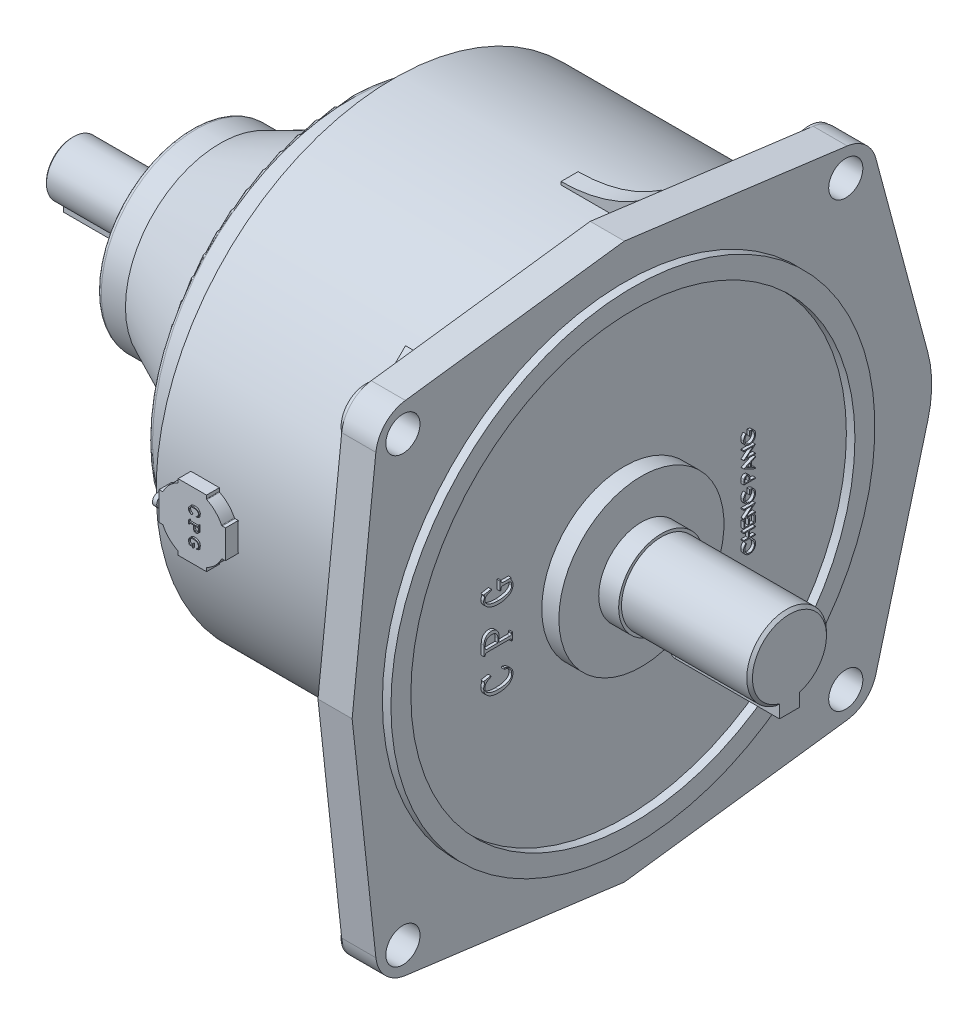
SolidWorks part; units mm, degrees
ref_plane "前视基准面" through (0, 0, 0) normal (0, 0, 1) x (1, 0, 0)
ref_plane "上视基准面" through (0, 0, 0) normal (0, 1, 0) x (1, 0, 0)
ref_plane "右视基准面" through (0, 0, 0) normal (1, 0, 0) x (0, 0, -1)
sketch "草图1" plane through (0, 0, 0) normal (0, 1, 0) x (1, 0, 0)
  line L0 (0, 0) -> (15.7361, 0) construction
  line L1 (0, 0) -> (0, -14)
  line L2 (0, -14) -> (-45, -14)
  line L3 (-45, -14) -> (-45, -15)
  line L4 (-45, -15) -> (-52, -15)
  line L5 (-55, -29) -> (-55, -85)
  line L6 (-55, -85) -> (-58, -85)
  line L7 (-58, -85) -> (-58, 0)
  line L8 (-58, 0) -> (0, 0)
  line L9 (-55, -29) -> (-52, -29)
  line L10 (-52, -29) -> (-52, -15)
  dimension "D1" = 45
  dimension "D2" = 28
  dimension "D3" = 30
  dimension "D4" = 3
  dimension "D5" = 170
  dimension "D6" = 58
  dimension "D7" = 3
  dimension "D8" = 58
revolve "旋转1" add sketch "草图1" angle 360 about L0
sketch "草图2" plane through (0, 0, 0) normal (0, 1, 0) x (1, 0, 0)
  line L0 (8.0167, 23) -> (-70, 23) construction
  line L4 (-70, 23) -> (-70, -60.5)
  line L5 (-70, -60.5) -> (-162, -60.5)
  line L6 (-162, -60.5) -> (-162, 23)
  line L11 (-70, 23) -> (-162, 23)
  dimension "D1" = 23
  dimension "D3" = 167
  dimension "D5" = 92
revolve "旋转2" add sketch "草图2" angle 360 about L0
sketch "草图12" plane through (-70, 0, 0) normal (1, 0, 0) x (0, 0, -1)
  line L0 (0, -97.5) -> (86.267, -86.267)
  line L1 (-86.267, -86.267) -> (0, -97.5)
  line L2 (-86.267, -86.267) -> (-95.6178, 0)
  line L3 (-86.267, 86.267) -> (0, 97.5)
  line L4 (86.267, -86.267) -> (109.3822, 0)
  line L5 (-95.6178, 0) -> (-86.267, 86.267)
  line L6 (0, 97.5) -> (86.267, 86.267)
  line L7 (109.3822, 0) -> (86.267, 86.267)
  line L8 (167.8979, 0) -> (-107.2143, 0) construction
  line L9 (0, 107.5085) -> (0, -103.3164) construction
  line L10 (0, 0) -> (-77.7817, 77.7817) construction
  line L11 (0, 0) -> (77.7817, 77.7817) construction
  circle A0 centre (0, 0) radius 110 construction
  circle A1 centre (-77.7817, 77.7817) radius 6
  circle A2 centre (77.7817, 77.7817) radius 6
  circle A3 centre (77.7817, -77.7817) radius 6
  circle A4 centre (-77.7817, -77.7817) radius 6
  dimension "D3" = 220
  dimension "D4" = 12
  dimension "D5" = 15
  dimension "D1" = 195
  dimension "D2" = 205
  dimension "D6" = 12
extrude "拉伸8" add sketch "草图12" along normal up to surface (12 mm away)
sketch "草图5" plane through (0, 0, 0) normal (0, 1, 0) x (1, 0, 0)
  line L0 (0, -3.5) -> (-36.5, -3.5)
  line L1 (0, -14) -> (0, 14) construction
  line L2 (-36.5, 3.5) -> (0, 3.5)
  line L3 (0, 3.5) -> (0, -3.5)
  line L4 (31.1, -13.7955) -> (31.1, 19.6443) construction
  arc A0 (-36.5, -3.5) -> (-36.5, 3.5) centre (-36.5, 0) cw
  dimension "D2" = 40
  dimension "D1" = 7
  dimension "D3" = 31.1
extrude "拉伸4" add sketch "草图5" against normal blind 17.1
fillet "圆角4" radius 12 4 edges at (-64, 86.267, 86.267) (-64, 86.267, -86.267) (-64, -86.267, -86.267) (-64, -86.267, 86.267)
fillet "圆角5" radius 40 1 edges at (-64, 0, -109.3822)
chamfer "倒角1" distance 1 angle 45 1 edges at (0, 14, 0)
sketch "草图18" plane through (-70, 0, 0) normal (-1, 0, 0) x (0, 0, 1)
  line L0 (-23, 0) -> (65.9169, -88.9169) construction
  line L1 (0, -89.1) -> (0, 89.1) construction
  line L2 (76.9039, -87.4862) -> (0, -97.5) construction
  line L3 (36.0434, -59.0434) -> (65.9169, -88.9169)
  line L4 (-23, 0) -> (-77.7817, -77.7817) construction
  line L5 (-76.7543, -75.4044) -> (-71.081, -68.2676)
  line L7 (-23, 0) -> (-23, -94.5051) construction
  line L8 (0, -97.5) -> (-78.3038, -87.3039) construction
  line L9 (-23, -83.5) -> (-23, -94.5051)
  circle A0 centre (-23, 0) radius 83.5 construction
  arc A1 (-88.3455, -78.5102) -> (-78.3038, -87.3039) centre (-76.7543, -75.4044) ccw construction
  circle A3 centre (-23, 0) radius 83.5 construction
  dimension "D1" = 45
  dimension "D2" = 9.117
  dimension "D4" = 42.2474
  dimension "D5" = 11.0051
ref_plane "基准面7" through (-71, 0, 0) normal (1, 0, 0) x (0, 0, -1)
sketch "草图13" plane through (-70, 0, 0) normal (1, 0, 0) x (0, 0, -1)
  line L5 (0, 0) -> (107.7406, 0) construction
  circle A1 centre (77.7817, 77.7817) radius 9.4101
  circle A3 centre (77.7817, 77.7817) radius 6
  circle A4 centre (77.7817, -77.7817) radius 6 construction
  circle A5 centre (77.7817, -77.7817) radius 6
  circle A7 centre (-77.7817, -77.7817) radius 6
  arc A10 (78.3038, -87.3039) -> (88.3455, -78.5102) centre (76.7543, -75.4044) ccw construction
  circle A11 centre (-77.7817, -77.7817) radius 6 construction
  arc A12 (-87.2845, -76.8798) -> (-76.9039, -87.4862) centre (-75.3544, -75.5867) ccw construction
  circle A14 centre (-77.7817, 77.7817) radius 6
  circle A15 centre (-77.7817, 77.7817) radius 8.7273
  circle A20 centre (-77.7817, -77.7817) radius 8.7273
  circle A21 centre (77.7817, -77.7817) radius 9.4101
  point P8 (23, 0)
extrude "拉伸9" add sketch "草图13" against normal up to surface (1 mm away)
sketch "草图14" plane through (0, 0, 0) normal (0, 1, 0) x (1, 0, 0)
  line L0 (-70, 23) -> (-162, 23) construction
  line L5 (-70, -76.9039) -> (-70, 0) construction
  line L6 (-100.2474, -60.5) -> (-100.2474, -61.5)
  line L7 (-70, -90.7474) -> (-71, -90.7474)
  line L9 (-70, -60.5) -> (-162, -60.5) construction
  arc A0 (-71, -90.7474) -> (-100.2474, -61.5) centre (-100.2474, -90.7474) ccw
  dimension "D1" = 113.7474
  dimension "D2" = 1
  dimension "D3" = 1
rib "筋17" sketch "草图14" sketch "草图14" thickness 6 extrusion direction parallel to sketch draft on no parameters "D1"=6
pattern_circular "阵列(圆周)16" count 8 over 360 about axis through (0, 0, -23) along (1, 0, 0) of "筋17"
ref_plane "基准面8" through (0, 0, -23) normal (0, 0, 1) x (1, 0, 0)
sketch "草图17" plane through (0, 0, -23) normal (0, 0, 1) x (1, 0, 0)
  line L0 (-70, -93.5051) -> (-71, -93.5051)
  line L1 (-70, -87.4862) -> (-70, -97.5) construction
  line L2 (-100.2474, -83.5) -> (-100.2474, -84.5)
  line L4 (-162, -83.5) -> (-70, -83.5) construction
  line L6 (-100.2474, -61.8718) -> (-100.2474, -57.6292) construction
  arc A0 (-71, -93.5051) -> (-100.2474, -84.5) centre (-100.2474, -136.4984) ccw
  dimension "D1" = 10.0051
  dimension "D2" = 1
  dimension "D3" = 1
rib "筋24" sketch "草图17" sketch "草图17" thickness 6 extrusion direction parallel to sketch draft on no parameters "D1"=6
mirror "镜向1" about plane through (0, 0, 0) normal (0, 1, 0) of "筋24"
sketch "草圖1" plane through (0, 0, 0) normal (0, 1, 0) x (1, 0, 0)
  line L0 (-269.0797, 23) -> (-111.2984, 23) construction
  line L1 (-162, 23) -> (-275, 23)
  line L2 (-162.5, 92.75) -> (-177, 92.75)
  line L3 (-234.5, 32.75) -> (-234.5, 32.5)
  line L4 (-275, 32) -> (-274.5, 32.5)
  line L5 (-178.5, 76.75) -> (-223, 56.25)
  line L9 (-231.5, 56.25) -> (-223, 56.25)
  line L10 (-178.5, 91.25) -> (-178.5, 76.75)
  line L11 (-234.5, 32.5) -> (-274.5, 32.5)
  line L14 (-275, 23) -> (-275, 32)
  line L16 (-233, 32.75) -> (-234.5, 32.75)
  line L18 (-162, 92.25) -> (-162, 23)
  line L20 (-233, 32.75) -> (-233, 54.75)
  arc A0 (-162, 92.25) -> (-162.5, 92.75) centre (-162.5, 92.25) ccw
  arc A1 (-162, 92.25) -> (-162.5, 92.75) centre (-162.5, 92.25) ccw
  arc A2 (-231.5, 56.25) -> (-233, 54.75) centre (-231.5, 54.75) ccw
  arc A3 (-177, 92.75) -> (-178.5, 91.25) centre (-177, 91.25) ccw
  point P17 (-275, 32.5)
  dimension "D1" = 23
  dimension "D2" = 19
  dimension "D3" = 275
  dimension "D5" = 139.5
revolve "旋轉1" add sketch "草圖1" angle 360 about L0
ref_plane "平面1" through (0, 0, -23) normal (0, 0, 1) x (1, 0, 0)
sketch "草圖3" plane through (-55, 0, 0) normal (1, 0, 0) x (0, 0, -1)
  circle A0 centre (0, 0) radius 78
  circle A1 centre (0, 0) radius 29 construction
  circle A2 centre (0, 0) radius 29
  dimension "D1" = 156
extrude "伸長2" cut sketch "草圖3" against normal blind 3
sketch "草圖4"
  dimension "D1" = 70
  dimension "D2" = 70
  dimension "D3" = 40
  dimension "D4" = 45
  dimension "D5" = 35
extrude "伸長3" add sketch "草圖4" along normal blind 1
sketch "草圖5" plane through (0, 0, 0) normal (0, 1, 0) x (1, 0, 0)
  line L0 (-302.0703, 23) -> (-227.5958, 23) construction
  line L1 (-275, 20) -> (-243, 20)
  line L2 (-275, 32) -> (-275, 14) construction
  line L3 (-243, 26) -> (-275, 26)
  line L4 (-275, 26) -> (-275, 20)
  line L5 (-240, 23) -> (-240, 5.8162) construction
  line L6 (-296.7, 23) -> (-296.7, 8.4192) construction
  arc A0 (-243, 20) -> (-243, 26) centre (-243, 23) ccw
  dimension "D1" = 9.5
  dimension "D2" = 6
  dimension "D3" = 3
  dimension "D4" = 35
  dimension "D5" = 21.7
extrude "伸長4" add sketch "草圖5" against normal blind 12.2
ref_plane "平面2" through (0, 0, 64.8) normal (0, 0, 1) x (1, 0, 0)
sketch "草圖6" plane through (0, 0, 64.8) normal (0, 0, 1) x (1, 0, 0)
  line L0 (-149.96, 11.65) -> (-139.96, 11.65)
  line L1 (-149.96, 11.65) -> (-149.96, 10.5119)
  line L2 (-139.96, 11.65) -> (-139.96, 10.5119)
  line L3 (-149.96, -10.5119) -> (-149.96, -11.65)
  line L4 (-139.96, -10.5119) -> (-139.96, -11.65)
  line L5 (-156.61, 5) -> (-155.4719, 5)
  line L6 (-156.61, -5) -> (-155.4719, -5)
  line L7 (-156.61, -5) -> (-156.61, 5)
  line L8 (-149.96, -11.65) -> (-149.96, -10.5119)
  line L9 (-139.96, -11.65) -> (-139.96, -10.5119)
  line L10 (-139.96, -11.65) -> (-149.96, -11.65)
  line L11 (-133.31, -5) -> (-134.4481, -5)
  line L12 (-133.31, 5) -> (-134.4481, 5)
  line L13 (-133.31, 5) -> (-133.31, -5)
  arc A0 (-150.0983, 10.2882) -> (-155.2482, 5.1383) centre (-144.96, 0) ccw
  arc A1 (-150.0983, 10.2882) -> (-149.96, 10.5119) centre (-150.21, 10.5119) ccw
  arc A2 (-139.96, 10.5119) -> (-139.8217, 10.2882) centre (-139.71, 10.5119) ccw
  arc A3 (-155.4719, 5) -> (-155.2482, 5.1383) centre (-155.4719, 5.25) ccw
  arc A4 (-155.2482, -5.1383) -> (-155.4719, -5) centre (-155.4719, -5.25) ccw
  arc A5 (-149.96, -10.5119) -> (-150.0983, -10.2882) centre (-150.21, -10.5119) ccw
  arc A6 (-139.8217, -10.2882) -> (-139.96, -10.5119) centre (-139.71, -10.5119) ccw
  arc A7 (-134.4481, -5) -> (-134.6718, -5.1383) centre (-134.4481, -5.25) ccw
  arc A8 (-134.6718, 5.1383) -> (-134.4481, 5) centre (-134.4481, 5.25) ccw
  arc A9 (-134.6718, 5.1383) -> (-139.8217, 10.2882) centre (-144.96, 0) ccw
  arc A10 (-155.2482, -5.1383) -> (-150.0983, -10.2882) centre (-144.96, 0) ccw
  arc A11 (-139.8217, -10.2882) -> (-134.6718, -5.1383) centre (-144.96, 0) ccw
extrude "伸長5" add sketch "草圖6" against normal blind 4.5 separate body contours A6 A11 A7 L11 L13 L12 A8 A9 A2 L2 L0 L1 A1 A0 A3 L5 L7 L6 A4 A10 A5 L3 L10 L4
sketch "草圖7"
extrude "伸長6" add sketch "草圖7" along normal blind 0.5
sketch "草圖8" plane through (0, 0, 0) normal (0, 1, 0) x (1, 0, 0)
  line L0 (-159.0104, -62.75) -> (-151.0104, -62.75)
  line L1 (-159.0104, -62.75) -> (-159.0104, -60.75)
  line L2 (-157.5104, -61.5) -> (-157.5104, -60.75)
  line L13 (-155.5104, -61.5) -> (-151.0104, -61.75)
  line L15 (-157.5104, -61.5) -> (-155.5104, -61.5)
  line L23 (-159.0104, -60.75) -> (-157.5104, -60.75)
  line L24 (-155.5104, -62.75) -> (-155.5104, -61.5)
  line L25 (-151.0104, -62.75) -> (-151.0104, -61.75)
revolve "旋轉2" add sketch "草圖8" angle 360 about L0
equation "\"D3@草图1\" = \"D2@草图1\"+2"
equation "\"D1@拉伸4\" = \"D3@草图5\"-\"D2@草图1\"/2"
equation "\"D5@草图1\" = \"D1@草圖3\"+14"
equation "\"D1@伸長4\" = \"D5@草圖5\"-\"D2@草圖1\"/2"
